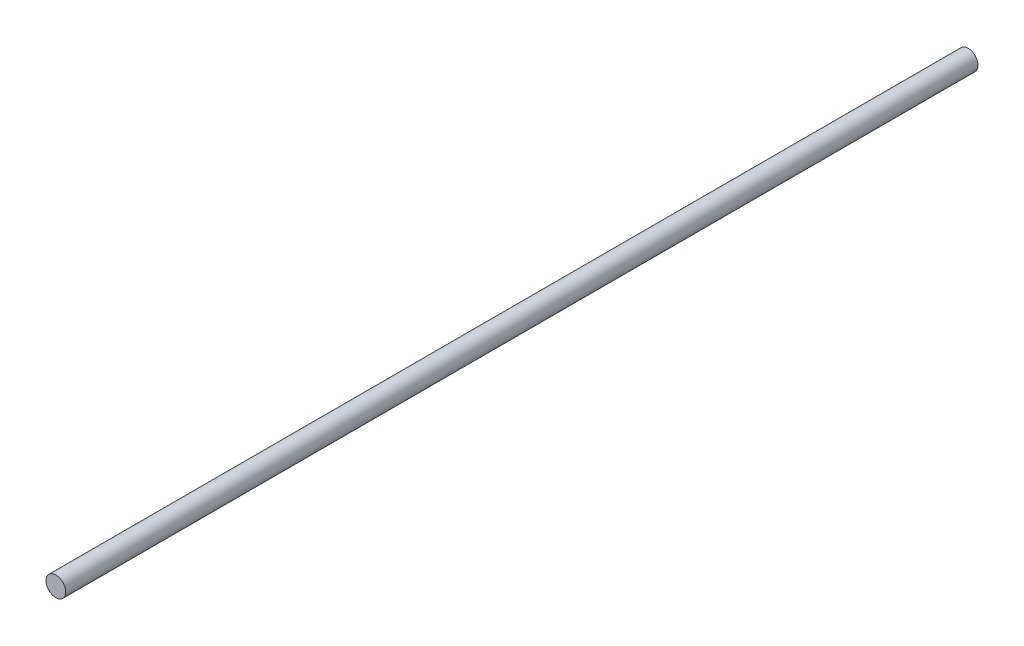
SolidWorks part; units mm, degrees
ref_plane "Alzado" through (0, 0, 0) normal (0, 0, 1) x (1, 0, 0)
ref_plane "Planta" through (0, 0, 0) normal (0, 1, 0) x (1, 0, 0)
ref_plane "Vista lateral" through (0, 0, 0) normal (1, 0, 0) x (0, 0, -1)
sketch "Croquis1" plane through (0, 0, 0) normal (0, 0, 1) x (1, 0, 0)
  circle A0 centre (0, 0) radius 4
  dimension "D1" = 8
extrude "Saliente-Extruir1" add sketch "Croquis1" along normal blind 370
